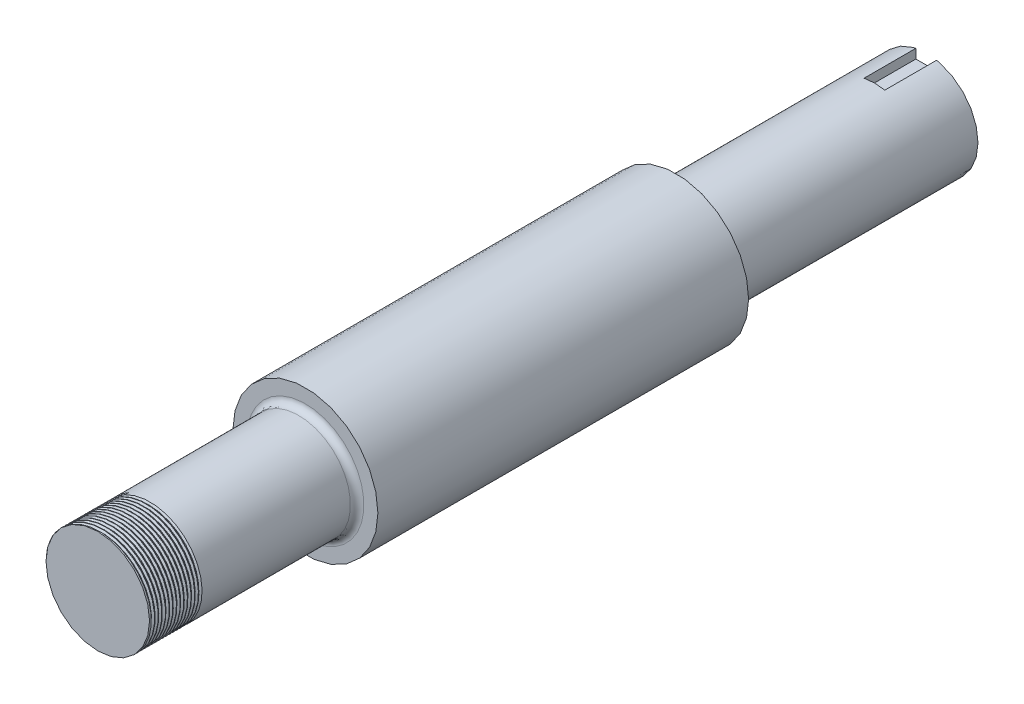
SolidWorks part; units mm, degrees
ref_plane "Front Plane" through (0, 0, 0) normal (0, 0, 1) x (1, 0, 0)
ref_plane "Top Plane" through (0, 0, 0) normal (0, 1, 0) x (1, 0, 0)
ref_plane "Right Plane" through (0, 0, 0) normal (1, 0, 0) x (0, 0, -1)
sketch "Sketch Spindle Skeleton" plane through (0, 0, 0) normal (1, 0, 0) x (0, 0, -1)
  line L5 (-1000, 0) -> (49000, 0)
  line L6 (0, -9.5) -> (0, 9.5)
  line L13 (0, 9.5) -> (-48.3, 9.5)
  line L26 (-48.3, 9.5) -> (-48.3, 14)
  line L27 (-48.3, 14) -> (-119.9, 14)
  line L32 (-119.9, 14) -> (-119.9, 9.5)
  line L33 (-119.9, 9.5) -> (-160, 9.5)
  line L34 (-160, 9.5) -> (-160, -9.5)
  line L35 (-160, -9.5) -> (-119.9, -9.5)
  line L36 (-119.9, -9.5) -> (-119.9, -14)
  line L37 (-119.9, -14) -> (-48.3, -14)
  line L38 (-48.3, -14) -> (-48.3, -9.5)
  line L39 (0, -9.5) -> (-48.3, -9.5)
  line L40 (-24.2, 36) -> (-19.2, 36)
  line L41 (-136.5, 22.5) -> (-119.9, 22.5)
  line L42 (-136.5, 22.5) -> (-136.5, -22.5)
  line L43 (-136.5, -22.5) -> (-119.9, -22.5)
  line L44 (-119.9, 22.5) -> (-119.9, -22.5)
  line L45 (-136.5, 22.5) -> (-119.9, -22.5) construction
  line L46 (-136.5, -22.5) -> (-119.9, 22.5) construction
  line L47 (-31.7, 22.5) -> (-48.3, 22.5)
  line L48 (-31.7, 22.5) -> (-31.7, -22.5)
  line L49 (-31.7, -22.5) -> (-48.3, -22.5)
  line L50 (-48.3, 22.5) -> (-48.3, -22.5)
  line L51 (-31.7, 22.5) -> (-48.3, -22.5) construction
  line L52 (-31.7, -22.5) -> (-48.3, 22.5) construction
  line L59 (-19.2, 36) -> (-19.2, -36)
  line L60 (-19.2, -36) -> (-24.2, -36)
  line L61 (-24.2, -22.5) -> (-29.2, -22.5)
  line L62 (-29.2, -22.5) -> (-29.2, -17.5)
  line L63 (-29.2, -17.5) -> (-24.2, -17.5)
  line L64 (-24.2, -17.5) -> (-24.2, 17.5)
  line L65 (-24.2, 17.5) -> (-29.2, 17.5)
  line L66 (-29.2, 17.5) -> (-29.2, 22.5)
  line L67 (-29.2, 22.5) -> (-24.2, 22.5)
  line L68 (-24.2, 22.5) -> (-24.2, 36)
  line L69 (-24.2, -22.5) -> (-24.2, -36)
  line L71 (-141.5, 36) -> (-25.2, 36)
  line L72 (-141.5, 36) -> (-141.5, -36)
  line L73 (-141.5, -36) -> (-25.2, -36)
  line L74 (-25.2, 36) -> (-25.2, -36)
  line L75 (-141.5, 36) -> (-25.2, -36) construction
  line L76 (-141.5, -36) -> (-25.2, 36) construction
  point P3 (0, 0)
  point P18 (-128.2, 0)
  point P24 (-40, 0)
  point P29 (-83.35, 0)
  point P48 (-19.2, 29.25)
revolve "Revolve Spindle" add sketch "Sketch Spindle Skeleton" angle 360 about L5
fillet "Bearing Rest Fillet 0.13cm " radius 1.3 2 edges at (9.5, 0, 119.9) (9.5, 0, 48.3)
thread "Chuck Thread" pitch 0.7056 start angle 0, offset 0, length 10, pitch 0.7056, diameter 19
ref_plane "Plane2" through (-9.5, 0, 160) normal (0, -1, 0) x (-1, 0, 0)
sketch "Thread Profile2" plane through (-9.5, 0, 160) normal (0, -1, 0) x (-1, 0, 0)
  line L0 (0, 0) -> (0, 0.7056) construction
  line L11 (0, 0) -> (0, 0.6174)
  line L12 (0, 0.6174) -> (-0.3819, 0.3969)
  line L13 (-0.3819, 0.3969) -> (-0.3819, 0.2205)
  line L15 (-0.3819, 0.2205) -> (0, 0)
  line L17 (-0.3819, 0.3087) -> (0, 0.3087) construction
  point P2 (0, 0)
  dimension "Pitch" = 0.7056
  dimension "Profile_Angle" = 60
  dimension "Profile_Land" = 0.1764
  dimension "Profile_Height" = 0.3819
sketch "Sketch Key" plane through (0, 0, 0) normal (0, 0, -1) x (-1, 0, 0)
  line L0 (0, 8.5) -> (0, 0) construction
  line L1 (-2, 7.5) -> (2, 7.5)
  line L2 (-2, 7.5) -> (-2, 9.5)
  line L3 (-2, 9.5) -> (2, 9.5)
  line L4 (2, 7.5) -> (2, 9.5)
  line L5 (-2, 7.5) -> (2, 9.5) construction
  line L6 (-2, 9.5) -> (2, 7.5) construction
  circle A1 centre (0, 0) radius 9.5
  circle A2 centre (0, 0) radius 9.5
  point P0 (0, 8.5)
  dimension "D2" = 4
  dimension "D3" = 2
  dimension "D1" = 0
extrude "Key Cut" cut sketch "Sketch Key" against normal blind 10 contours L3 L4 L1 L2
